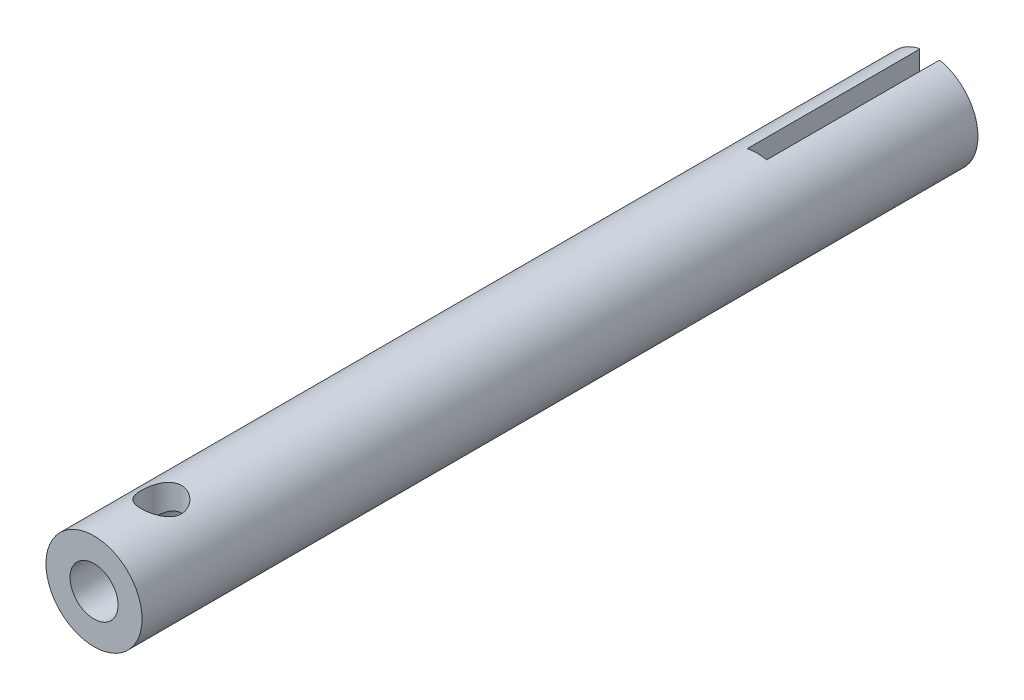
SolidWorks part; units mm, degrees
ref_plane "Piano frontale" through (0, 0, 0) normal (0, 0, 1) x (1, 0, 0)
ref_plane "Piano superiore" through (0, 0, 0) normal (0, 1, 0) x (1, 0, 0)
ref_plane "Piano destro" through (0, 0, 0) normal (1, 0, 0) x (0, 0, -1)
sketch "Schizzo1" plane through (0, 0, 0) normal (0, 0, 1) x (1, 0, 0)
  circle A0 centre (0, 0) radius 5
  dimension "D1" = 10
extrude "Estrusione-Estrusione1" add sketch "Schizzo1" along normal blind 87
hole_wizard "Foro Ø5.0 (5)-1" positions "Schizzo3" profile "Schizzo4" hole size "Ø5.0" standard "ISO"
sketch "Schizzo3" plane through (0, 0, 87) normal (0, 0, 1) x (1, 0, 0)
  point P0 (0, 0)
sketch "Schizzo4" plane through (0, 0, 87) normal (1, 0, 0) x (0, -1, 0)
  line L0 (0, 0) -> (0, 25)
  line L1 (0, 25) -> (2.5, 23.4978)
  line L2 (2.5, 23.4978) -> (2.5, 0)
  line L5 (2.5, 0) -> (0, 0)
  line L10 (0, 25) -> (-2.5, 23.4978) construction
  line L11 (0, -6.35) -> (0, 107.95) construction
  dimension "Hole Dia." = 5
  dimension "Hole Depth" = 25
  dimension "Drill Angle" = 118
sketch "Schizzo5" plane through (0, 0, 0) normal (0, 0, -1) x (-1, 0, 0)
  line L1 (-1.01, 5.5) -> (1.01, 5.5)
  line L2 (-1.01, 5.5) -> (-1.01, -5.5)
  line L3 (-1.01, -5.5) -> (1.01, -5.5)
  line L4 (1.01, 5.5) -> (1.01, -5.5)
  line L5 (-1.01, 5.5) -> (1.01, -5.5) construction
  line L6 (-1.01, -5.5) -> (1.01, 5.5) construction
  point P0 (0, 0)
extrude "Taglio-Estrusione1" cut sketch "Schizzo5" against normal blind 18
chamfer "Smusso1" distance 0.1 angle 45 2 edges at (1.01, 0, 0) (-1.01, 0, 0)
ref_plane "Piano1" through (0, 5, 0) normal (0, 1, 0) x (1, 0, 0)
hole_wizard "Foro filettato M5-1" positions "Schizzo6" profile "Schizzo7" tap size "M5" standard "ISO"
sketch "Schizzo6" plane through (0, 5, 0) normal (0, 1, 0) x (1, 0, 0)
  point P0 (0, -80)
  dimension "D1" = 80
sketch "Schizzo7" plane through (0, 5, 80) normal (1, 0, 0) x (0, 0, 1)
  line L0 (0, 0) -> (0, 2.5)
  line L1 (0, 2.5) -> (2.1, 2.5)
  line L2 (2.1, 2.5) -> (2.1, 0)
  line L5 (2.1, 0) -> (0, 0)
  line L11 (0, -6.35) -> (0, 107.95) construction
  dimension "Thru Tap Drill Dia." = 4.2
  dimension "Thru Tap Drill Depth" = 2.5
equation "\"D1@Schizzo5\"=2+0.01*2"
